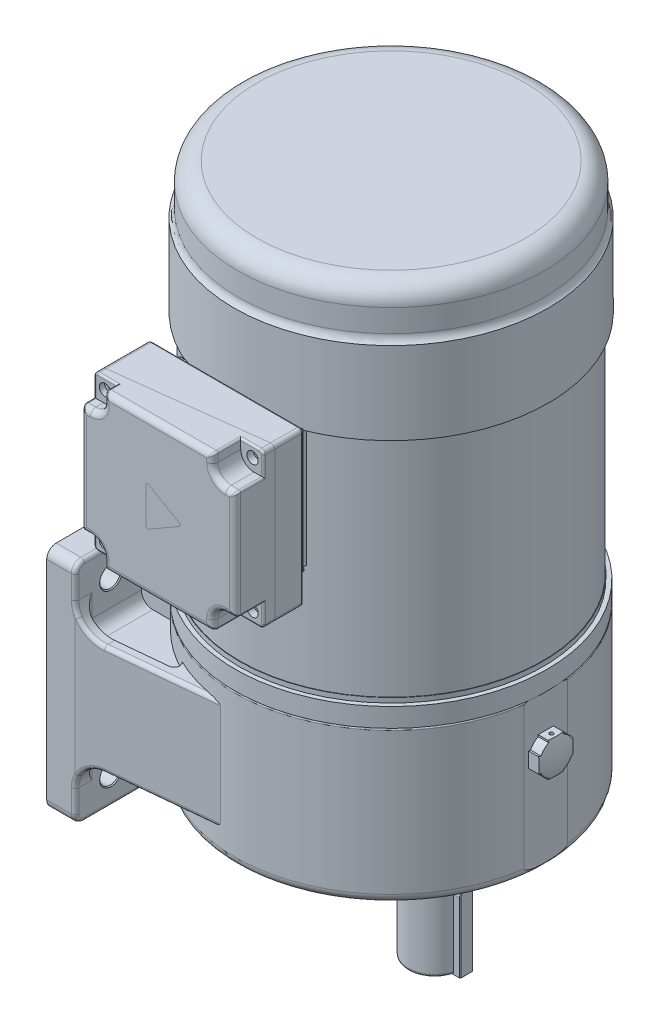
SolidWorks part; units mm, degrees
ref_plane "前视基准面" through (0, 0, 0) normal (0, 0, 1) x (1, 0, 0)
ref_plane "上视基准面" through (0, 0, 0) normal (0, 1, 0) x (1, 0, 0)
ref_plane "右视基准面" through (0, 0, 0) normal (1, 0, 0) x (0, 0, -1)
imported_body "接线盒座-1-surface1"
imported_body "接线盒座-1-surface2"
imported_body "接线盒座-1-surface3"
imported_body "接线盒座-1-surface4"
imported_body "接线盒座-1-surface5"
imported_body "接线盒座-1-surface6"
imported_body "接线盒座-1-surface7"
imported_body "接线盒盖-1-surface1"
imported_body "接线盒盖-1-surface2"
imported_body "接线盒盖-1-surface3"
imported_body "卧式箱体装配体-1/A版修模 28箱体-1-surface1"
imported_body "卧式箱体装配体-1/A版修模 28箱体-1-surface2"
imported_body "卧式箱体装配体-1/A版修模 28箱体-1-surface3"
imported_body "卧式箱体装配体-1/A版修模 28箱体-1-surface4"
imported_body "卧式箱体装配体-1/A版修模 28箱体-1-surface5"
imported_body "卧式箱体装配体-1/A版修模 28箱体-1-surface6"
imported_body "卧式箱体装配体-1/A版修模 28箱体-1-surface7"
imported_body "卧式箱体装配体-1/A版修模 28箱体-1-surface8"
imported_body "卧式箱体装配体-1/A版修模 28箱体-1-surface9"
imported_body "卧式箱体装配体-1/16.04.20 28箱盖配B版电机1500-1-surface1"
imported_body "卧式箱体装配体-1/16.04.20 28箱盖配B版电机1500-1-surface2"
imported_body "卧式箱体装配体-1/16.04.20 28箱盖配B版电机1500-1-surface3"
imported_body "卧式箱体装配体-1/16.04.20 28箱盖配B版电机1500-1-surface4"
imported_body "卧式箱体装配体-1/16.04.20 28箱盖配B版电机1500-1-surface5"
imported_body "卧式箱体装配体-1/16.04.20 28箱盖配B版电机1500-1-surface6"
imported_body "卧式箱体装配体-1/16.04.20 28箱盖配B版电机1500-1-surface7"
imported_body "卧式箱体装配体-1/GB／T13871．1-2007唇形密封圈B型B15 30X45X7-1-surface1"
imported_body "卧式箱体装配体-1/透气塞-1-surface1"
imported_body "卧式箱体装配体-1/7X40-1-surface1"
sketch "草图1" plane through (0, -136.0217, 0) normal (0, 1, 0) x (1, 0, 0)
  circle A0 centre (71.682, -0.8259) radius 80
extrude "凸台-拉伸1" add sketch "草图1" along normal blind 122
sketch "草图2" plane through (0, -14.0217, 0) normal (0, 1, 0) x (1, 0, 0)
  circle A0 centre (71.682, -0.8259) radius 83
extrude "凸台-拉伸2" add sketch "草图2" along normal blind 43.5
sketch "草图3" plane through (0, 29.4783, 0) normal (0, 1, 0) x (1, 0, 0)
  circle A0 centre (71.682, -0.8259) radius 81
extrude "凸台-拉伸3" add sketch "草图3" along normal blind 26
fillet "圆角1" radius 10 1 edges at (71.682, 55.4783, 81.8259)
fillet "圆角3" radius 5 1 edges at (71.682, 29.4783, 81.8259)
